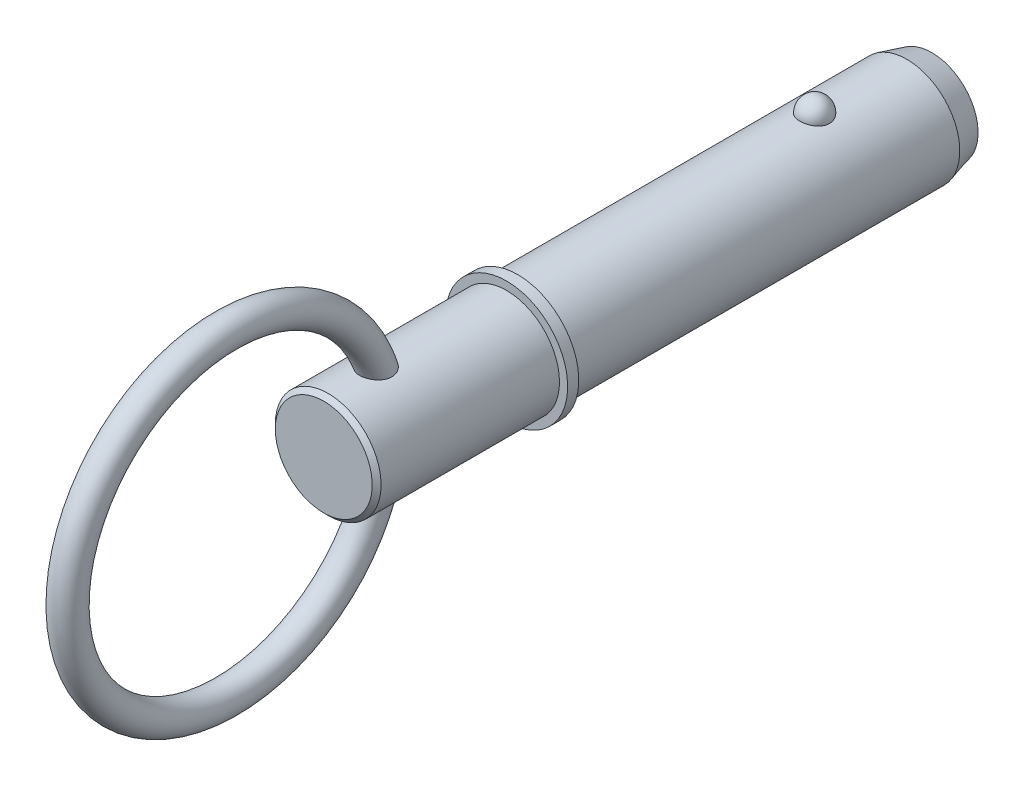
SolidWorks part; units mm, degrees
ref_plane "Front Plane" through (0, 0, 0) normal (0, 0, 1) x (1, 0, 0)
ref_plane "Top Plane" through (0, 0, 0) normal (0, 1, 0) x (1, 0, 0)
ref_plane "Right Plane" through (0, 0, 0) normal (1, 0, 0) x (0, 0, -1)
sketch "Sketch2" plane through (0, 0, 0) normal (0, 0, 1) x (1, 0, 0)
  circle A0 centre (0, 0) radius 9.525
  point P3 (0, 9.525)
  dimension "D1" = 19.05
extrude "Boss-Extrude1" add sketch "Sketch2" along normal blind 50.8
sketch "Sketch3" plane through (0, 0, 0) normal (0, 0, -1) x (-1, 0, 0)
  circle A0 centre (0, 0) radius 9.525
  dimension "D1" = 19.05
extrude "Boss-Extrude2" add sketch "Sketch3" along normal blind 23.8
chamfer "Chamfer1" distance 4.5 angle 15 1 edges at (-9.525, 0, -23.8)
sketch "Sketch18" plane through (0, 0, 0) normal (1, 0, 0) x (0, 0, -1)
  line L0 (19.3, 9.525) -> (-50.8, 9.525) construction
  line L1 (2.69, 12.215) -> (2.69, 6.835)
  line L2 (-50.8, -9.525) -> (19.3, -9.525) construction
  arc A0 (2.69, 12.215) -> (2.69, 6.835) centre (2.69, 9.525) ccw
  point P4 (0, 9.525)
  dimension "D1" = 21.74
revolve "Revolve1" add sketch "Sketch18" angle 360 about L1
sketch "Sketch19" plane through (0, 0, 0) normal (1, 0, 0) x (0, 0, -1)
  line L0 (-33.7288, 0) -> (-46.4542, 0) construction
sketch "Sketch20" plane through (0, 0, 0) normal (1, 0, 0) x (0, 0, -1)
  line L0 (-50.8, 0) -> (-50.8, 11)
  line L1 (-50.8, 9.525) -> (-50.8, -9.525) construction
  line L2 (-50.8, 11) -> (-52.8, 11)
  line L3 (-52.8, 11) -> (-52.8, 0)
  line L4 (-33.7288, 0) -> (-46.4542, 0) construction
  line L5 (-52.8, 0) -> (-50.8, 0)
  dimension "D1" = 11
  dimension "D2" = 2
revolve "Revolve2" add sketch "Sketch20" angle 360 about L0
sketch "Sketch21" plane through (0, 0, 50.8) normal (0, 0, -1) x (-1, 0, 0)
  circle A0 centre (0, 0) radius 9.525
  dimension "D1" = 19.05
extrude "Boss-Extrude3" add sketch "Sketch21" against normal blind 34.93
chamfer "Chamfer2" distance 0.8 angle 45 1 edges at (-9.525, 0, 85.73)
sketch "Sketch23" plane through (0, 0, 0) normal (1, 0, 0) x (0, 0, -1)
  line L0 (-85.73, 8.725) -> (-85.73, -8.725) construction
  circle A0 centre (-103.305, 0) radius 28.575
  point P2 (-74.73, 0)
  dimension "D1" = 57.15
  dimension "D2" = 11
sketch "Sketch24" plane through (0, 0, 0) normal (0, 1, 0) x (1, 0, 0)
  circle A0 centre (0, -74.73) radius 2.75
  dimension "D1" = 5.5
sweep "Sweep1" add profiles "Sketch24" path "Sketch23"
